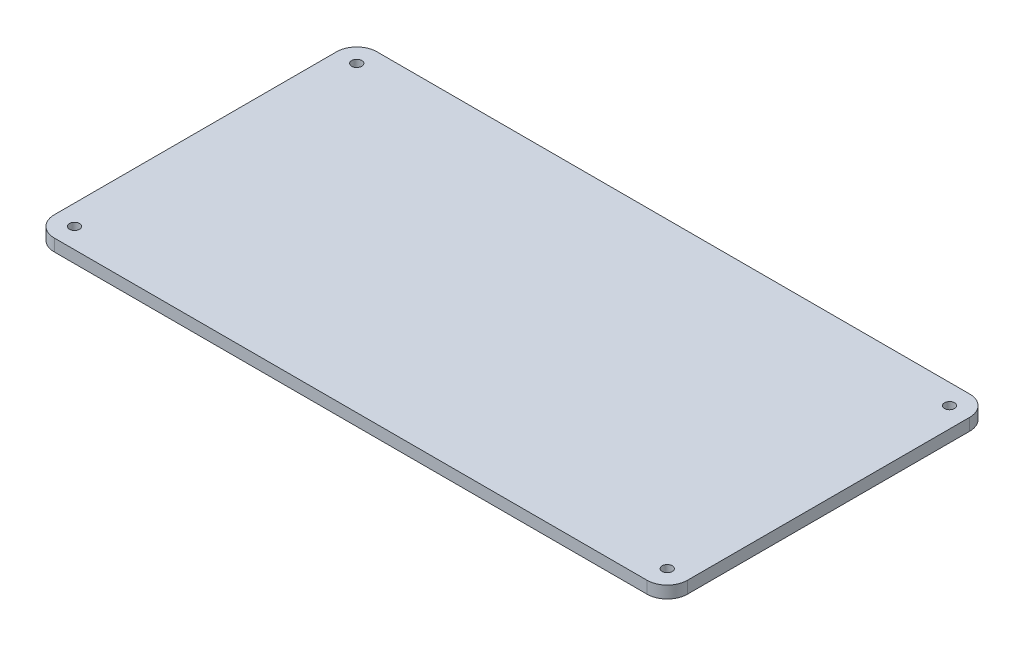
SolidWorks part; units mm, degrees
ref_plane "Front Plane" through (0, 0, 0) normal (0, 0, 1) x (1, 0, 0)
ref_plane "Top Plane" through (0, 0, 0) normal (0, 1, 0) x (1, 0, 0)
ref_plane "Right Plane" through (0, 0, 0) normal (1, 0, 0) x (0, 0, -1)
sketch "Sketch1" plane through (0, 0, 0) normal (0, 1, 0) x (1, 0, 0)
  line L0 (-1000, 0) -> (0, 0) construction
  line L1 (0, -30) -> (0, 30)
  line L2 (0, 30) -> (65, 30) construction
  line L3 (65, 30) -> (77, 40) construction
  line L4 (77, 40) -> (157, 40)
  line L15 (157, -40) -> (157, 40)
  line L16 (77, -40) -> (157, -40)
  line L17 (65, -30) -> (77, -40) construction
  line L18 (0, -30) -> (65, -30) construction
  line L19 (77, 40) -> (0, 40)
  line L20 (0, 40) -> (0, 30)
  line L21 (0, -30) -> (0, -40)
  line L22 (0, -40) -> (77, -40)
  point P6 (0, 0)
  dimension "D2" = 65
  dimension "D3" = 12
  dimension "D4" = 80
  dimension "D6" = 10
  dimension "D7" = 80
  dimension "D8" = 30
extrude "Boss-Extrude1" add sketch "Sketch1" along normal blind 3
fillet "Fillet1" radius 5 4 edges at (157, 1.5, 40) (0, 1.5, 40) (0, 1.5, -40) (157, 1.5, -40)
sketch "Sketch2" plane through (0, 3, 0) normal (0, 1, 0) x (1, 0, 0)
  circle A0 centre (5, 35) radius 1.25
  circle A1 centre (152, 35) radius 1.25
  circle A2 centre (152, -35) radius 1.25
  circle A3 centre (5, -35) radius 1.25
  dimension "D1" = 2.5
  dimension "D2" = 2.5
  dimension "D3" = 2.5
  dimension "D4" = 2.5
extrude "Cut-Extrude1" cut sketch "Sketch2" against normal blind 10
